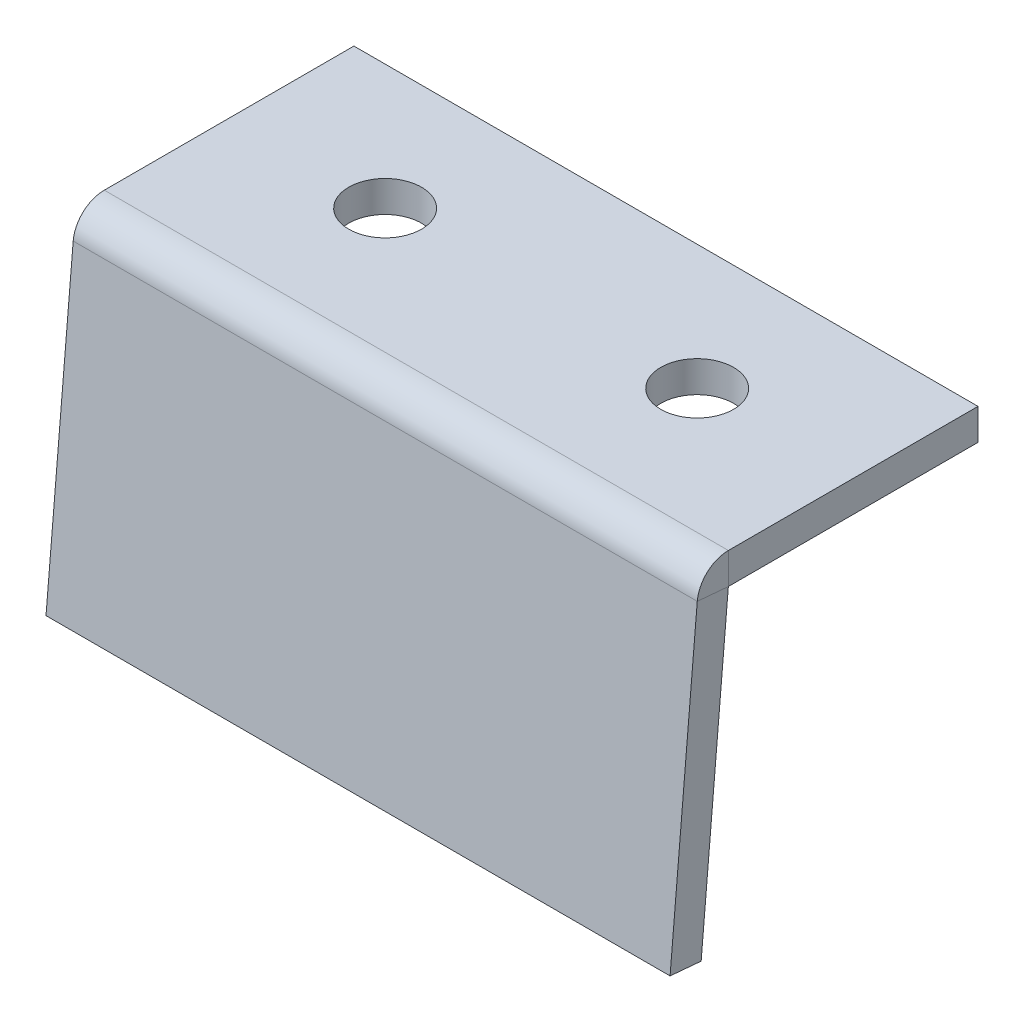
SolidWorks part; units mm, degrees
ref_plane "Front Plane" through (0, 0, 0) normal (0, 0, 1) x (1, 0, 0)
ref_plane "Top Plane" through (0, 0, 0) normal (0, 1, 0) x (1, 0, 0)
ref_plane "Right Plane" through (0, 0, 0) normal (1, 0, 0) x (0, 0, -1)
sketch "Sketch1" plane through (0, 0, 0) normal (0, 1, 0) x (1, 0, 0)
  line L0 (0, 21) -> (30, 21) construction
  line L1 (0, 0) -> (30, 0)
  line L2 (0, 0) -> (0, 27)
  line L3 (0, 27) -> (30, 27)
  line L4 (30, 0) -> (30, 27)
  line L5 (15, 27) -> (15, 0) construction
  circle A0 centre (7.5, 21) radius 1.75
  circle A1 centre (22.5, 21) radius 1.75
  dimension "D1" = 3.5
  dimension "D2" = 15
  dimension "D3" = 7.5
  dimension "D4" = 30
  dimension "D5" = 27
  dimension "D6" = 6
sheet metal parameters "Sheet-Metal1" thickness 1.5 parameters "D1"=1
base flange "Base-Flange1" sketch "Sketch1" thickness 1.5 reverse thickness direction yes parameters "D1"=1
sketch "Sketch3" plane through (0, 1.5, 0) normal (0, 1, 0) x (1, 0, 0)
  line L0 (0, 15) -> (30, 15)
  line L1 (0, 27) -> (0, 0) construction
  line L2 (30, 0) -> (30, 27) construction
  line L3 (30, 27) -> (0, 27) construction
  dimension "D1" = 12
sketched bend "Sketched Bend1" parameters "D1"=0.001
bend "SketchBend1" bend radius 0.001 bend angle 85 parameters "D5"=1
flat pattern "Flat-Pattern1"
sketch "Bend-Lines1" plane through (0, 0, 0) normal (0, 1, 0) x (-1, 0, 0)
bend of the flat pattern "Flatten-<SketchBend1>1"
